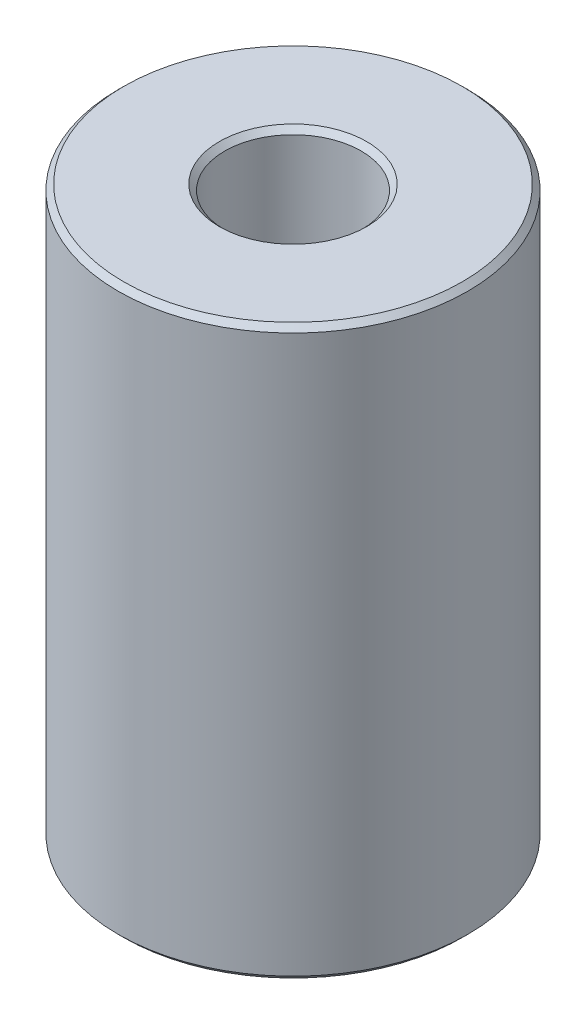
SolidWorks part; units mm, degrees
ref_plane "Plan de face" through (0, 0, 0) normal (0, 0, 1) x (1, 0, 0)
ref_plane "Plan de dessus" through (0, 0, 0) normal (0, 1, 0) x (1, 0, 0)
ref_plane "Plan de droite" through (0, 0, 0) normal (1, 0, 0) x (0, 0, -1)
sketch "Esquisse1" plane through (0, 0, 0) normal (0, 1, 0) x (1, 0, 0)
  circle A0 centre (0, 0) radius 6.25
  circle A1 centre (0, 0) radius 16
  dimension "D1" = 32
  dimension "D2" = 12.5
extrude "Boss.-Extru.1" add sketch "Esquisse1" along normal blind 52
chamfer "Chanfrein1" distance 0.5 angle 45 4 edges at (0, 0, 6.25) (0, 0, 16) (0, 52, 6.25) (0, 52, 16)
